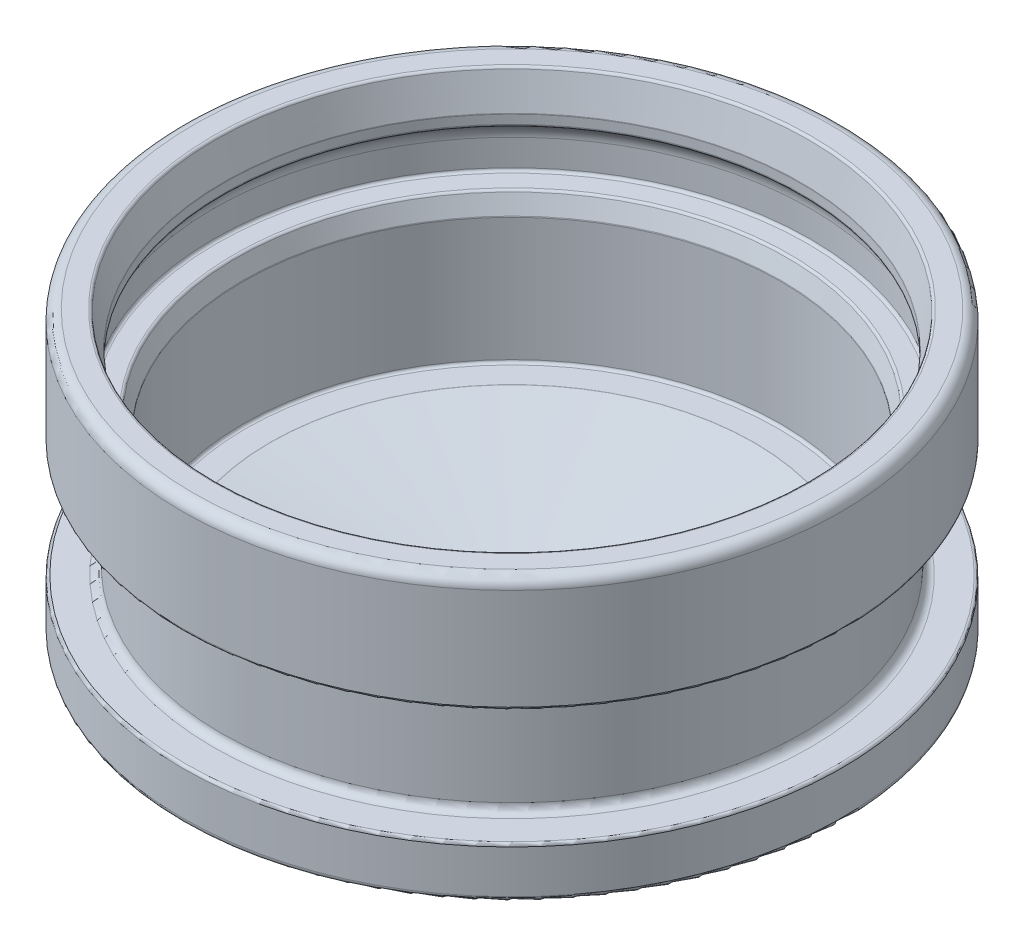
SolidWorks part; units mm, degrees
ref_plane "Front Plane" through (0, 0, 0) normal (0, 0, 1) x (1, 0, 0)
ref_plane "Top Plane" through (0, 0, 0) normal (0, 1, 0) x (1, 0, 0)
ref_plane "Right Plane" through (0, 0, 0) normal (1, 0, 0) x (0, 0, -1)
sketch "Sketch1" plane through (0, 0, 0) normal (0, 0, 1) x (1, 0, 0)
  line L0 (0, 0) -> (0, -14.5174) construction
  line L1 (-14.138, 0) -> (-15.0495, 0)
  line L2 (-15.5575, -0.508) -> (-15.5575, -5.2832)
  line L3 (-15.4305, -5.4102) -> (-14.097, -5.4102)
  line L4 (-13.716, -5.7912) -> (-13.716, -10.4902)
  line L5 (-14.097, -10.8712) -> (-15.4305, -10.8712)
  line L6 (-15.5575, -10.9982) -> (-15.5575, -13.0302)
  line L7 (-15.3035, -13.2842) -> (-1.8034, -13.2842)
  line L8 (-1.7272, -13.208) -> (-1.7272, -12.967)
  line L9 (-1.79, -12.892) -> (-11.4234, -11.1772)
  line L10 (-11.4367, -11.176) -> (-12.573, -11.176)
  line L11 (-12.7, -11.049) -> (-12.7, -5.2294)
  line L12 (-12.7077, -5.186) -> (-12.9932, -4.4016)
  line L13 (-14.0147, -0.0963) -> (-13.6309, -1.6359)
  line L14 (-13.6271, -1.6666) -> (-13.6271, -2.0863)
  line L15 (-14.097, -2.943) -> (-14.097, -4.191)
  line L16 (-13.97, -4.318) -> (-13.1125, -4.318)
  arc A0 (-13.6858, -2.1934) -> (-14.097, -2.943) centre (-13.208, -2.943) ccw
  arc A1 (-15.0495, 0) -> (-15.5575, -0.508) centre (-15.0495, -0.508) ccw
  arc A2 (-14.138, 0) -> (-14.0147, -0.0963) centre (-14.138, -0.127) cw
  arc A3 (-13.6309, -1.6359) -> (-13.6271, -1.6666) centre (-13.7541, -1.6666) cw
  arc A4 (-13.6271, -2.0863) -> (-13.6858, -2.1934) centre (-13.7541, -2.0863) cw
  arc A5 (-14.097, -4.191) -> (-13.97, -4.318) centre (-13.97, -4.191) ccw
  arc A6 (-12.9932, -4.4016) -> (-13.1125, -4.318) centre (-13.1125, -4.445) ccw
  arc A7 (-12.7, -5.2294) -> (-12.7077, -5.186) centre (-12.827, -5.2294) ccw
  arc A8 (-15.5575, -5.2832) -> (-15.4305, -5.4102) centre (-15.4305, -5.2832) ccw
  arc A9 (-12.573, -11.176) -> (-12.7, -11.049) centre (-12.573, -11.049) cw
  arc A10 (-15.4305, -10.8712) -> (-15.5575, -10.9982) centre (-15.4305, -10.9982) ccw
  arc A11 (-15.5575, -13.0302) -> (-15.3035, -13.2842) centre (-15.3035, -13.0302) ccw
  arc A12 (-11.4234, -11.1772) -> (-11.4367, -11.176) centre (-11.4367, -11.2522) ccw
  arc A13 (-1.7272, -12.967) -> (-1.79, -12.892) centre (-1.8034, -12.967) ccw
  arc A14 (-1.8034, -13.2842) -> (-1.7272, -13.208) centre (-1.8034, -13.208) ccw
  arc A15 (-14.097, -5.4102) -> (-13.716, -5.7912) centre (-14.097, -5.7912) cw
  arc A16 (-13.716, -10.4902) -> (-14.097, -10.8712) centre (-14.097, -10.4902) cw
  point P27 (-13.6271, -1.651)
  point P30 (-13.6271, -2.159)
  point P35 (-13.0236, -4.318)
  point P38 (-12.7, -5.207)
  point P45 (-15.5575, -10.8712)
  point P48 (-15.5575, -13.2842)
  point P51 (-11.43, -11.176)
  point P54 (-1.7272, -12.9032)
  point P57 (-1.7272, -13.2842)
  point P60 (-13.716, -5.4102)
  point P63 (-13.716, -10.8712)
  dimension "D18" = 28.194
  dimension "D19" = 0.508
  dimension "D16" = 1.778
  dimension "D20" = 0.508
  dimension "D21" = 0.127
  dimension "D22" = 0.254
  dimension "D23" = 0.0762
  dimension "D24" = 0.381
  dimension "D1" = 31.115
  dimension "D2" = 13.2842
  dimension "D3" = 2.413
  dimension "D4" = 5.461
  dimension "D5" = 27.432
  dimension "D6" = 11.176
  dimension "D7" = 25.4
  dimension "D8" = 0.381
  dimension "D9" = 22.86
  dimension "D10" = 3.4544
  dimension "D11" = 5.969
  dimension "D12" = 20
  dimension "D13" = 27.2542
  dimension "D14" = 1.651
  dimension "D15" = 14
  dimension "D17" = 4.318
revolve "Revolve1" add sketch "Sketch1" angle 360 about L0
